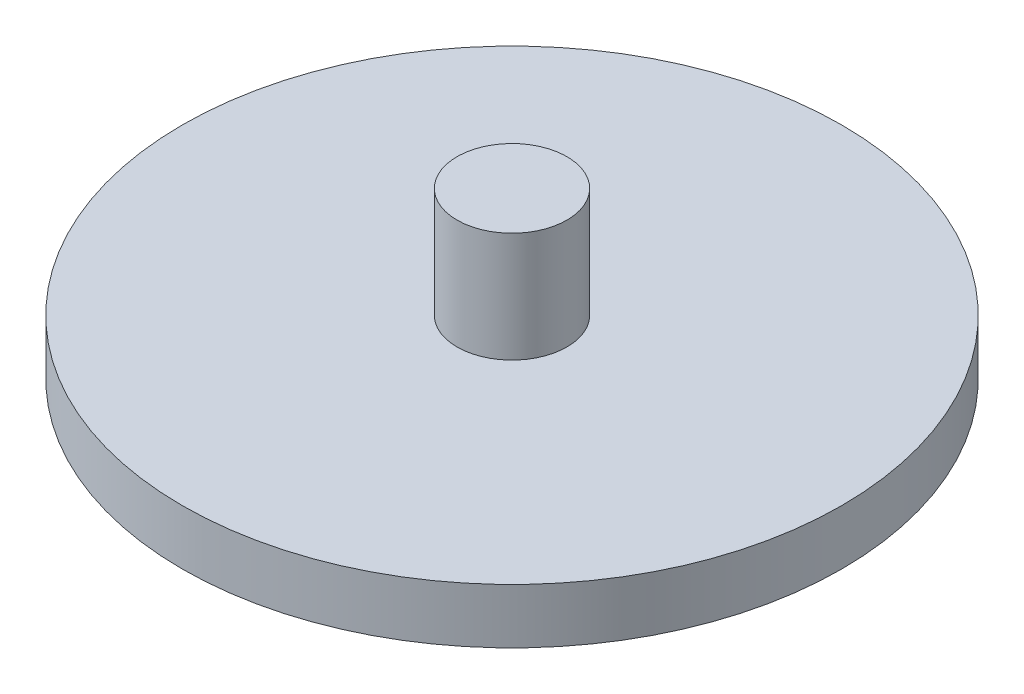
SolidWorks part; units mm, degrees
ref_plane "Front Plane" through (0, 0, 0) normal (0, 0, 1) x (1, 0, 0)
ref_plane "Top Plane" through (0, 0, 0) normal (0, 1, 0) x (1, 0, 0)
ref_plane "Right Plane" through (0, 0, 0) normal (1, 0, 0) x (0, 0, -1)
sketch "Sketch1" plane through (0, 0, 0) normal (0, 1, 0) x (1, 0, 0)
  circle A0 centre (0, 0) radius 25.4
  dimension "D1" = 50.8
extrude "Boss-Extrude1" add sketch "Sketch1" along normal blind 50.8
sketch "Sketch2" plane through (0, 0, 0) normal (0, -1, 0) x (1, 0, 0)
  circle A0 centre (0, 0) radius 152.4
  dimension "D1" = 304.8
extrude "Boss-Extrude2" add sketch "Sketch2" along normal blind 25.4
sketch "Sketch3" plane through (0, -25.4, 0) normal (0, -1, 0) x (1, 0, 0)
  line L0 (-63.5, 0) -> (63.5, 0)
  line L1 (27.94, 0) -> (-27.94, 0) construction
  line L2 (0, -27.94) -> (0, 27.94) construction
  line L3 (-63.5, -27.94) -> (-63.5, 27.94)
  line L4 (-63.5, 27.94) -> (63.5, 27.94)
  line L5 (63.5, 27.94) -> (63.5, -3.2168)
  line L6 (63.5, -27.94) -> (63.5, 3.2168)
  line L7 (-63.5, -27.94) -> (63.5, -27.94)
  point P8 (0, 0)
  dimension "D1" = 55.88
  dimension "D2" = 127
extrude "Boss-Extrude3" add sketch "Sketch3" along normal blind 55.88 contours L5 L4 L3 L0 | L3 L7 L6 L5 L0
sketch "Sketch4" plane through (-63.5, 0, 0) normal (-1, 0, 0) x (0, 0, 1)
  line L0 (-27.94, -25.4) -> (27.94, -81.28)
  circle A0 centre (0, -53.34) radius 20.32
extrude "Cut-Extrude1" cut sketch "Sketch4" against normal through all contours A0
